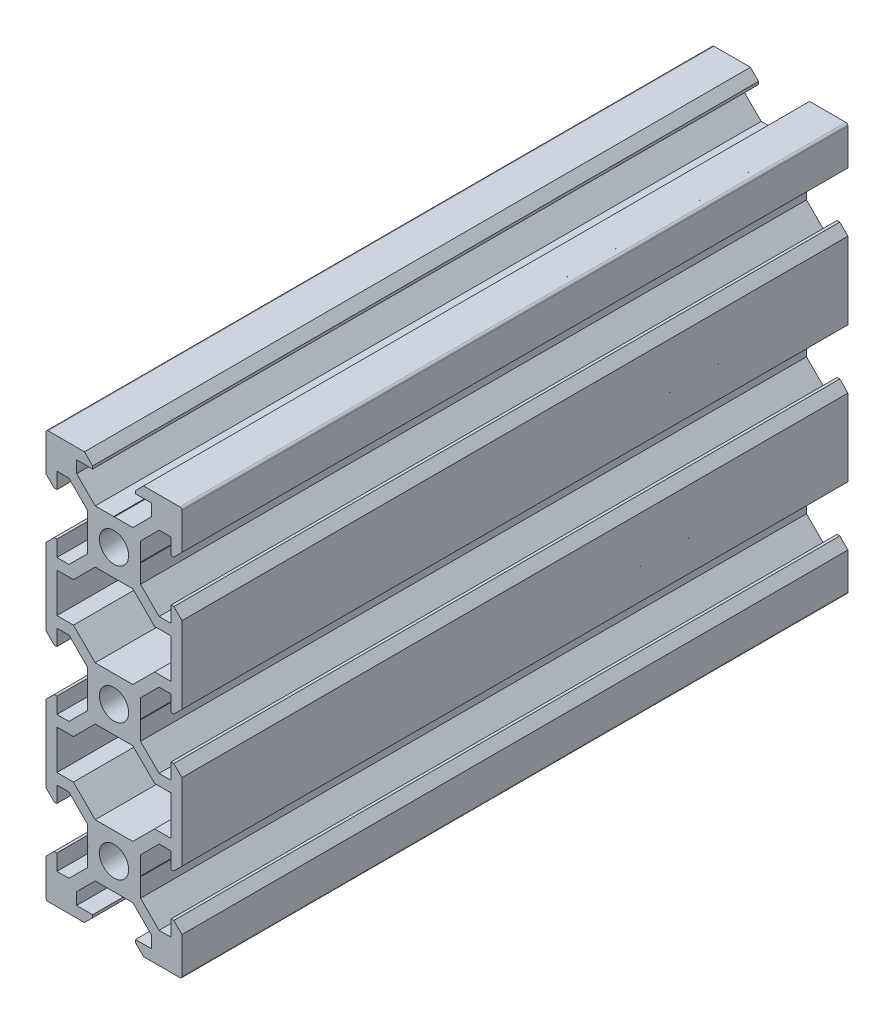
SolidWorks part; units mm, degrees
ref_plane "Front Plane" through (0, 0, 0) normal (0, 0, 1) x (1, 0, 0)
ref_plane "Top Plane" through (0, 0, 0) normal (0, 1, 0) x (1, 0, 0)
ref_plane "Right Plane" through (0, 0, 0) normal (1, 0, 0) x (0, 0, -1)
sketch "Sketch1" plane through (0, 0, 0) normal (0, 0, 1) x (1, 0, 0)
  line B0 (-2.7686, 16.0974) -> (-5.9674, 12.8986)
  line B1 (-5.9674, 12.8986) -> (-8.4, 12.8986)
  line B2 (-8.4, 12.8986) -> (-8.4, 7.0986)
  line B3 (-8.4, 7.0986) -> (-5.9705, 7.0986)
  line B4 (-5.9705, 7.0986) -> (-2.7698, 3.8986)
  line B5 (-2.7698, 3.8986) -> (2.7674, 3.8986)
  line B6 (2.7674, 3.8986) -> (5.9674, 7.0986)
  line B7 (5.9674, 7.0986) -> (8.4, 7.0986)
  line B8 (8.4, 7.0986) -> (8.4, 12.8986)
  line B9 (8.4, 12.8986) -> (5.9674, 12.8986)
  line B10 (5.9674, 12.8986) -> (2.7686, 16.0974)
  line B11 (2.7686, 16.0974) -> (-2.7686, 16.0974)
  line B12 (5.9674, -12.9) -> (8.4, -12.9)
  line B13 (-8.4, -7.1) -> (-8.4, -12.9)
  line B14 (8.4, -7.1) -> (5.9674, -7.1)
  line B15 (-2.7686, -3.9012) -> (-5.9674, -7.1)
  line B16 (-5.9705, -12.9) -> (-2.7698, -16.1)
  line B17 (2.7686, -3.9012) -> (-2.7686, -3.9012)
  line B18 (2.7674, -16.1) -> (5.9674, -12.9)
  line B19 (5.9674, -7.1) -> (2.7686, -3.9012)
  line B20 (-8.4, -12.9) -> (-5.9705, -12.9)
  line B21 (-5.9674, -7.1) -> (-8.4, -7.1)
  line B22 (8.4, -12.9) -> (8.4, -7.1)
  line B23 (-2.7698, -16.1) -> (2.7674, -16.1)
  line B24 (10, 24.3486) -> (10, 29.6986)
  line B25 (9.7, 29.9986) -> (4.35, 29.9986)
  line B26 (4.35, 29.9986) -> (3.15, 28.7986)
  line B27 (3.15, 28.7986) -> (3.15, 28.398)
  line B28 (3.15, 28.398) -> (5.5, 28.3986)
  line B29 (5.5, 28.3986) -> (5.5, 26.631)
  line B30 (5.5, 26.631) -> (2.767, 23.8974)
  line B31 (2.767, 23.8974) -> (0.0581, 23.8974)
  line B32 (0.0581, 23.8974) -> (0.0004, 23.7974)
  line B33 (0.0004, 23.7974) -> (-0.0573, 23.8974)
  line B34 (-0.0573, 23.8974) -> (-2.7662, 23.8974)
  line B35 (-2.7662, 23.8974) -> (-5.5, 26.6312)
  line B36 (-5.5, 26.6312) -> (-5.5, 28.3986)
  line B37 (-5.5, 28.3986) -> (-3.15, 28.3986)
  line B38 (-3.15, 28.3986) -> (-3.15, 28.7986)
  line B39 (-3.15, 28.7986) -> (-4.35, 29.9986)
  line B40 (-4.35, 29.9986) -> (-9.7, 29.9986)
  line B41 (-10, 29.6986) -> (-10, 24.3486)
  line B42 (-10, 24.3486) -> (-8.8, 23.1486)
  line B43 (-8.8, 23.1486) -> (-8.4, 23.1486)
  line B44 (-8.4, 23.1486) -> (-8.4, 25.4986)
  line B45 (-8.4, 25.4986) -> (-6.6385, 25.4986)
  line B46 (-6.6385, 25.4986) -> (-3.9, 22.7619)
  line B47 (-3.9, 22.7619) -> (-3.9, 20.0531)
  line B48 (-3.9, 20.0531) -> (-3.8, 19.9954)
  line B49 (-3.8, 19.9954) -> (-3.9, 19.9376)
  line B50 (-3.9, 19.9376) -> (-3.9, 17.2288)
  line B51 (-3.9, 17.2288) -> (-6.6295, 14.4986)
  line B52 (-6.6295, 14.4986) -> (-8.4, 14.4986)
  line B53 (-8.4, 14.4986) -> (-8.4, 16.8486)
  line B54 (-8.4, 16.8486) -> (-8.8, 16.8486)
  line B55 (-8.8, 16.8486) -> (-10, 15.6486)
  line B56 (-10, 15.6486) -> (-10, 4.3486)
  line B57 (-10, 4.3486) -> (-8.8, 3.1486)
  line B58 (-8.8, 3.1486) -> (-8.4, 3.1486)
  line B59 (-8.4, 3.1486) -> (-8.4, 5.4986)
  line B60 (-8.4, 5.4986) -> (-6.6326, 5.4986)
  line B61 (-6.6326, 5.4986) -> (-3.9, 2.7661)
  line B62 (-3.9, 2.7661) -> (-3.9001, 0.0564)
  line B63 (-3.9001, 0.0564) -> (-3.8002, -0.0014)
  line B64 (-3.8002, -0.0014) -> (-3.9, -0.0591)
  line B65 (-3.9, -0.0591) -> (-3.9002, -2.769)
  line B66 (-3.9002, -2.769) -> (-6.6326, -5.5014)
  line B67 (-6.6326, -5.5014) -> (-8.4, -5.5014)
  line B68 (-8.4, -5.5014) -> (-8.4, -3.1514)
  line B69 (-8.4, -3.1514) -> (-8.8, -3.1514)
  line B70 (-8.8, -3.1514) -> (-10, -4.3514)
  line B71 (-10, -4.3514) -> (-10, -15.6501)
  line B72 (-10, -15.6501) -> (-8.8, -16.8501)
  line B73 (-8.8, -16.8501) -> (-8.4, -16.8501)
  line B74 (-8.4, -16.8501) -> (-8.4, -14.5001)
  line B75 (-8.4, -14.5001) -> (-6.6315, -14.5001)
  line B76 (-6.6315, -14.5001) -> (-3.9, -17.2319)
  line B77 (-3.9, -17.2319) -> (-3.8998, -19.9424)
  line B78 (-3.8998, -19.9424) -> (-3.7996, -20.0001)
  line B79 (-3.7996, -20.0001) -> (-3.8998, -20.0581)
  line B80 (-3.8998, -20.0581) -> (-3.9, -22.7688)
  line B81 (-3.9, -22.7688) -> (-6.6314, -25.5007)
  line B82 (-6.6314, -25.5007) -> (-8.4, -25.5007)
  line B83 (-8.4, -25.5007) -> (-8.4, -23.1501)
  line B84 (-8.4, -23.1501) -> (-8.8, -23.1501)
  line B85 (-8.8, -23.1501) -> (-10, -24.3501)
  line B86 (-10, -24.3501) -> (-10, -29.7014)
  line B87 (-9.7, -30.0014) -> (-4.35, -30.0014)
  line B88 (-4.35, -30.0014) -> (-3.15, -28.8014)
  line B89 (-3.15, -28.8014) -> (-3.15, -28.4014)
  line B90 (-3.15, -28.4014) -> (-5.5, -28.4014)
  line B91 (-5.5, -28.4014) -> (-5.5, -26.6319)
  line B92 (-5.5, -26.6319) -> (-2.7682, -23.9005)
  line B93 (-2.7682, -23.9005) -> (-0.0573, -23.9005)
  line B94 (-0.0573, -23.9005) -> (0.0004, -23.8005)
  line B95 (0.0004, -23.8005) -> (0.0581, -23.9009)
  line B96 (0.0581, -23.9009) -> (2.769, -23.9014)
  line B97 (2.769, -23.9014) -> (5.4997, -26.6317)
  line B98 (5.4997, -26.6317) -> (5.5, -28.4014)
  line B99 (5.5, -28.4014) -> (3.15, -28.4014)
  line B100 (3.15, -28.4014) -> (3.15, -28.8014)
  line B101 (3.15, -28.8014) -> (4.35, -30.0014)
  line B102 (4.35, -30.0014) -> (9.7, -30.0014)
  line B103 (10, -29.7014) -> (10, -24.3501)
  line B104 (10, -24.3501) -> (8.8, -23.1501)
  line B105 (8.8, -23.1501) -> (8.4, -23.1501)
  line B106 (8.4, -23.1501) -> (8.4, -25.5001)
  line B107 (8.4, -25.5001) -> (6.6314, -25.5001)
  line B108 (6.6314, -25.5001) -> (3.9, -22.7688)
  line B109 (3.9, -22.7688) -> (3.9002, -20.0587)
  line B110 (3.9002, -20.0587) -> (3.8004, -20.001)
  line B111 (3.8004, -20.001) -> (3.9002, -19.943)
  line B112 (3.9002, -19.943) -> (3.9, -17.2331)
  line B113 (3.9, -17.2331) -> (6.6333, -14.5001)
  line B114 (6.6333, -14.5001) -> (8.4, -14.5001)
  line B115 (8.4, -14.5001) -> (8.4, -16.8501)
  line B116 (8.4, -16.8501) -> (8.8, -16.8501)
  line B117 (8.8, -16.8501) -> (10, -15.6501)
  line B118 (10, -15.6501) -> (10, -4.3514)
  line B119 (10, -4.3514) -> (8.8, -3.1514)
  line B120 (8.8, -3.1514) -> (8.4, -3.1514)
  line B121 (8.4, -3.1514) -> (8.4, -5.5014)
  line B122 (8.4, -5.5014) -> (6.6319, -5.5014)
  line B123 (6.6319, -5.5014) -> (3.9, -2.77)
  line B124 (3.9, -2.77) -> (3.8999, -0.0577)
  line B125 (3.8999, -0.0577) -> (3.7998, 0)
  line B126 (3.7998, 0) -> (3.8999, 0.0577)
  line B127 (3.8999, 0.0577) -> (3.9, 2.77)
  line B128 (3.9, 2.77) -> (6.6284, 5.4986)
  line B129 (6.6284, 5.4986) -> (8.4, 5.4986)
  line B130 (8.4, 5.4986) -> (8.4, 3.1486)
  line B131 (8.4, 3.1486) -> (8.8, 3.1486)
  line B132 (8.8, 3.1486) -> (10, 4.3486)
  line B133 (10, 4.3486) -> (10, 15.6486)
  line B134 (10, 15.6486) -> (8.8, 16.8486)
  line B135 (8.8, 16.8486) -> (8.4, 16.8486)
  line B136 (8.4, 16.8486) -> (8.4, 14.4986)
  line B137 (8.4, 14.4986) -> (6.6326, 14.4986)
  line B138 (6.6326, 14.4986) -> (3.9, 17.2312)
  line B139 (3.9, 17.2312) -> (3.9, 19.9409)
  line B140 (3.9, 19.9409) -> (3.8, 19.9986)
  line B141 (3.8, 19.9986) -> (3.9, 20.0564)
  line B142 (3.9, 20.0564) -> (3.9, 22.7661)
  line B143 (3.9, 22.7661) -> (6.6326, 25.4986)
  line B144 (6.6326, 25.4986) -> (8.4, 25.4986)
  line B145 (8.4, 25.4986) -> (8.4, 23.1486)
  line B146 (8.4, 23.1486) -> (8.8, 23.1486)
  line B147 (8.8, 23.1486) -> (10, 24.3486)
  circle B148 centre (0, 19.9986) radius 2.15
  circle B149 centre (0, 0) radius 2.15
  circle B150 centre (0.0004, -20.001) radius 2.15
  arc B151 (10, 29.6986) -> (9.7, 29.9986) centre (9.7, 29.6986) ccw
  arc B152 (-9.7, 29.9986) -> (-10, 29.6986) centre (-9.7, 29.6986) ccw
  arc B153 (-10, -29.7014) -> (-9.7, -30.0014) centre (-9.7, -29.7014) ccw
  arc B154 (9.7, -30.0014) -> (10, -29.7014) centre (9.7, -29.7014) ccw
sketch_block_instance "6020-1"
sketch_block "6020"
extrude "Boss-Extrude1" add sketch "Sketch1" along normal blind 98
